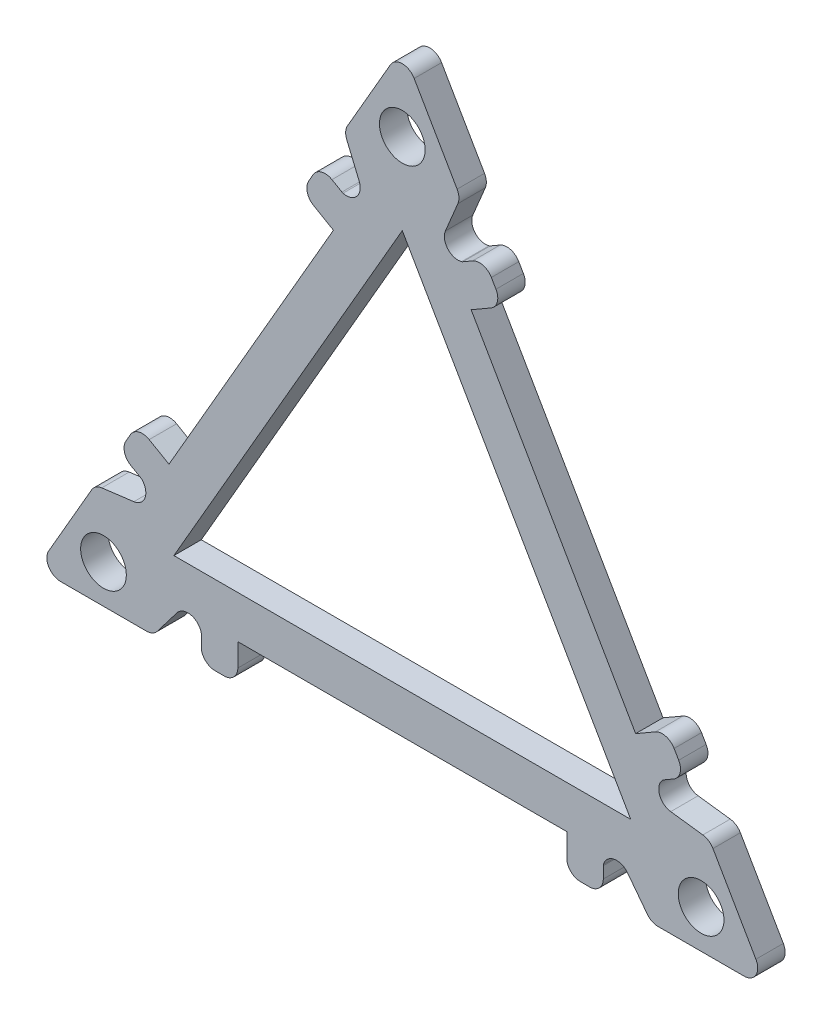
SolidWorks part; units mm, degrees
ref_plane "Front Plane" through (0, 0, 0) normal (0, 0, 1) x (1, 0, 0)
ref_plane "Top Plane" through (0, 0, 0) normal (0, 1, 0) x (1, 0, 0)
ref_plane "Right Plane" through (0, 0, 0) normal (1, 0, 0) x (0, 0, -1)
sketch "Sketch1" plane through (0, 0, 0) normal (0, 0, 1) x (1, 0, 0)
  line L0 (0, 46.188) -> (0, -23.094) construction
  line L1 (-37.4019, -23.094) -> (-28, -23.094)
  line L2 (38.701, -20.844) -> (34, -12.7017)
  line L3 (-1.299, 43.938) -> (-6, 35.7957)
  line L4 (-40, -23.094) -> (0, 0) construction
  line L5 (-23.094, 0) -> (23.094, 0) construction
  line L6 (-6.085, 34.4674) -> (-4.7183, 31.1968)
  line L7 (-20.5, -23.094) -> (-19.5, -23.094)
  line L8 (-7.5359, 25.1355) -> (-25.5359, -6.0415)
  line L9 (-34, -12.7017) -> (-38.701, -20.844)
  line L10 (-6.6085, 29.2188) -> (-7.701, 29.8496)
  line L11 (-7.5359, 25.1355) -> (-9.701, 26.3855)
  line L12 (-9.75, 29.3005) -> (-10.25, 28.4345)
  line L13 (20.5, -23.094) -> (19.5, -23.094)
  line L14 (18, -19.094) -> (18, -21.594)
  line L15 (22, -20.3325) -> (22, -21.594)
  line L16 (26.8071, -22.5034) -> (24.6581, -19.6846)
  line L17 (-26.8071, -22.5034) -> (-24.6581, -19.6846)
  line L18 (-22, -20.3325) -> (-22, -21.594)
  line L19 (-18, -19.094) -> (-18, -21.594)
  line L20 (-20.5, -23.094) -> (-19.5, -23.094)
  line L21 (-30.25, -6.2065) -> (-29.75, -5.3405)
  line L22 (-25.5359, -6.0415) -> (-27.701, -4.7915)
  line L23 (-28.6085, -8.8863) -> (-29.701, -8.2556)
  line L24 (-32.8921, -11.9639) -> (-29.3764, -11.5122)
  line L25 (-18, -19.094) -> (18, -19.094)
  line L26 (19.5, -23.094) -> (20.5, -23.094)
  line L27 (28, -23.094) -> (37.4019, -23.094)
  line L28 (32.8921, -11.9639) -> (29.3764, -11.5122)
  line L29 (28.6085, -8.8863) -> (29.701, -8.2556)
  line L30 (25.5359, -6.0415) -> (27.701, -4.7915)
  line L31 (30.25, -6.2065) -> (29.75, -5.3405)
  line L32 (9.75, 29.3005) -> (10.25, 28.4345)
  line L33 (7.5359, 25.1355) -> (9.701, 26.3855)
  line L34 (6.6085, 29.2188) -> (7.701, 29.8496)
  line L35 (7.5359, 25.1355) -> (25.5359, -6.0415)
  line L36 (6.085, 34.4674) -> (4.7183, 31.1968)
  line L37 (6, 35.7957) -> (1.299, 43.938)
  line L38 (10.25, 28.4345) -> (9.75, 29.3005)
  line L39 (30.25, -6.2065) -> (29.75, -5.3405)
  line L41 (-25, -14.4338) -> (25, -14.4338)
  line L42 (25, -14.4338) -> (0, 28.8675)
  line L43 (0, 28.8675) -> (-25, -14.4338)
  arc A0 (32.8921, -11.9639) -> (34, -12.7017) centre (32.701, -13.4517) cw
  arc A1 (-6.085, 34.4674) -> (-6, 35.7957) centre (-4.701, 35.0457) cw
  arc A2 (-6.4866, 29.1685) -> (-4.7183, 31.1968) centre (-6.1023, 30.6185) ccw
  arc A3 (28.504, -8.9667) -> (29.3764, -11.5122) centre (29.5675, -10.0245) ccw
  arc A4 (28.6085, -8.8863) -> (28.504, -8.9667) centre (28.8585, -9.3193) ccw
  arc A5 (-6.6085, 29.2188) -> (-6.4866, 29.1685) centre (-6.3585, 29.6518) ccw
  arc A6 (-9.75, 29.3005) -> (-7.701, 29.8496) centre (-8.451, 28.5505) cw
  arc A7 (-9.701, 26.3855) -> (-10.25, 28.4345) centre (-8.951, 27.6845) cw
  arc A8 (18, -21.594) -> (19.5, -23.094) centre (19.5, -21.594) ccw
  arc A9 (20.5, -23.094) -> (22, -21.594) centre (20.5, -21.594) ccw
  arc A10 (22, -20.3325) -> (22.0174, -20.2018) centre (22.5, -20.3325) cw
  arc A11 (22.0174, -20.2018) -> (24.6581, -19.6846) centre (23.4652, -20.594) cw
  arc A12 (26.8071, -22.5034) -> (28, -23.094) centre (28, -21.594) ccw
  arc A13 (-26.8071, -22.5034) -> (-28, -23.094) centre (-28, -21.594) cw
  arc A14 (-22.0174, -20.2018) -> (-24.6581, -19.6846) centre (-23.4652, -20.594) ccw
  arc A15 (-22, -20.3325) -> (-22.0174, -20.2018) centre (-22.5, -20.3325) ccw
  arc A16 (-20.5, -23.094) -> (-22, -21.594) centre (-20.5, -21.594) cw
  arc A17 (-18, -21.594) -> (-19.5, -23.094) centre (-19.5, -21.594) cw
  arc A18 (-27.701, -4.7915) -> (-29.75, -5.3405) centre (-28.451, -6.0905) ccw
  arc A19 (-30.25, -6.2065) -> (-29.701, -8.2556) centre (-28.951, -6.9565) ccw
  arc A20 (-28.6085, -8.8863) -> (-28.504, -8.9667) centre (-28.8585, -9.3193) cw
  arc A21 (-28.504, -8.9667) -> (-29.3764, -11.5122) centre (-29.5675, -10.0245) cw
  arc A22 (-32.8921, -11.9639) -> (-34, -12.7017) centre (-32.701, -13.4517) ccw
  arc A23 (30.25, -6.2065) -> (29.701, -8.2556) centre (28.951, -6.9565) cw
  arc A24 (27.701, -4.7915) -> (29.75, -5.3405) centre (28.451, -6.0905) cw
  arc A25 (9.701, 26.3855) -> (10.25, 28.4345) centre (8.951, 27.6845) ccw
  arc A26 (9.75, 29.3005) -> (7.701, 29.8496) centre (8.451, 28.5505) ccw
  arc A27 (6.6085, 29.2188) -> (6.4866, 29.1685) centre (6.3585, 29.6518) cw
  arc A28 (6.4866, 29.1685) -> (4.7183, 31.1968) centre (6.1023, 30.6185) cw
  arc A29 (6.085, 34.4674) -> (6, 35.7957) centre (4.701, 35.0457) ccw
  arc A30 (38.701, -20.844) -> (37.4019, -23.094) centre (37.4019, -21.594) cw
  arc A31 (-38.701, -20.844) -> (-37.4019, -23.094) centre (-37.4019, -21.594) ccw
  arc A32 (1.299, 43.938) -> (-1.299, 43.938) centre (0, 43.188) ccw
  circle A33 centre (0, 0) radius 14.4338 construction
  circle A34 centre (-32.701, -18.8799) radius 2.5
  circle A35 centre (32.701, -18.8799) radius 2.5
  circle A36 centre (0, 37.7598) radius 2.5
  point P19 (-33.7731, -12.3087)
  point P30 (-11, 27.1355)
  point P100 (11, 27.1355)
  point P101 (33.7731, -12.3087)
  point P104 (40, -23.094)
  dimension "D4" = 1.5
  dimension "D5" = 1.5
  dimension "D6" = 1.5
  dimension "D7" = 36
  dimension "D9" = 0.5
  dimension "D10" = 1.5
  dimension "D12" = 1.5
  dimension "D15" = 5
  dimension "D1" = 80
  dimension "D2" = 80
  dimension "D3" = 4
  dimension "D8" = 4
  dimension "D11" = 4
  dimension "D13" = 10
  dimension "D14" = 25
extrude "Boss-Extrude1" add sketch "Sketch1" along normal blind 3 contours L37 A32 L3 A1 L6 A2 A5 L10 A6 L12 A7 L11 L8 L22 A18 L21 A19 L23 A20 A21 L24 A22 L9 A31 L1 A13 L17 A14 A15 L18 A16 L7 A17 L19 L25 L14 A8 L13 A9 L15 A10 A11 L16 A12 L27 A30 L2 A0 L28 A3 A4
